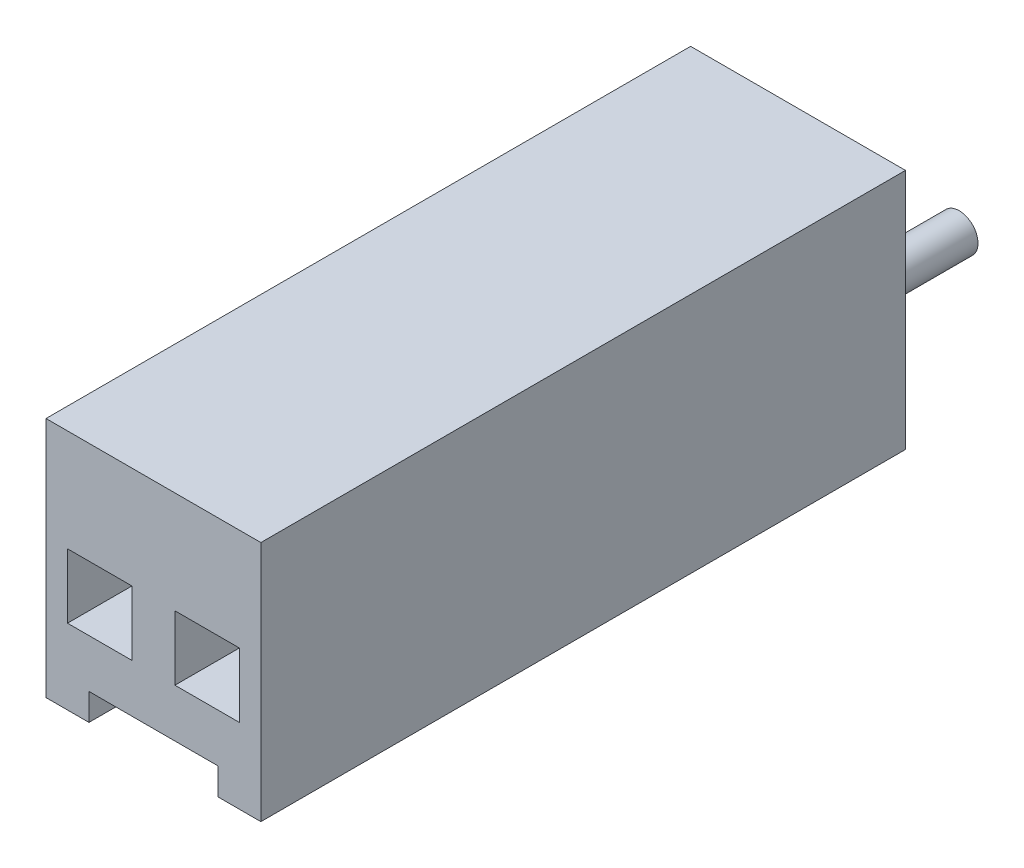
SolidWorks part; units mm, degrees
ref_plane "Front Plane" through (0, 0, 0) normal (0, 0, 1) x (1, 0, 0)
ref_plane "Top Plane" through (0, 0, 0) normal (0, 1, 0) x (1, 0, 0)
ref_plane "Right Plane" through (0, 0, 0) normal (1, 0, 0) x (0, 0, -1)
sketch "Sketch2" plane through (0, 0, 0) normal (0, 0, 1) x (1, 0, 0)
  line L1 (-1.27, 3.175) -> (3.81, 3.175)
  line L2 (-1.27, 3.175) -> (-1.27, -2.54)
  line L3 (-1.27, -2.54) -> (3.81, -2.54)
  line L4 (3.81, 3.175) -> (3.81, -2.54)
extrude "Boss-Extrude2" add sketch "Sketch2" along normal blind 2.54
sketch "Sketch3" plane through (0, 0, 2.54) normal (0, 0, 1) x (1, 0, 0)
  line L0 (-1.27, -2.54) -> (3.81, -2.54) construction
  line L1 (0, -2.54) -> (2.54, -2.54)
  line L2 (0, -2.54) -> (0, -1.905)
  line L3 (0, -1.905) -> (2.54, -1.905)
  line L4 (2.54, -2.54) -> (2.54, -1.905)
extrude "Boss-Extrude3" add sketch "Sketch3" along normal blind 7.62
sketch "Sketch4" plane through (0, 0, 2.54) normal (0, 0, 1) x (1, 0, 0)
  line L0 (3.81, -2.54) -> (3.81, 3.175) construction
  line L1 (-1.27, 3.175) -> (3.81, 3.175)
  line L2 (-1.27, 3.175) -> (-1.27, -1.905)
  line L3 (-1.27, -1.905) -> (3.81, -1.905)
  line L4 (3.81, 3.175) -> (3.81, -1.905)
extrude "Boss-Extrude4" add sketch "Sketch4" along normal blind 12.7
sketch "Sketch5" plane through (0, 0, 0) normal (0, 0, -1) x (-1, 0, 0)
  circle A0 centre (0, 0) radius 0.4445
  circle A1 centre (-2.54, 0) radius 0.4445
extrude "Boss-Extrude5" add sketch "Sketch5" along normal blind 2.54
sketch "Эскиз2" plane through (0, -1.905, 0) normal (0, -1, 0) x (1, 0, 0)
  line L1 (-1.27, 15.24) -> (-0.254, 15.24)
  line L2 (-1.27, 15.24) -> (-1.27, 2.54)
  line L3 (-1.27, 2.54) -> (-0.254, 2.54)
  line L4 (-0.254, 15.24) -> (-0.254, 2.54)
  line L5 (2.794, 15.24) -> (3.81, 15.24)
  line L6 (2.794, 15.24) -> (2.794, 2.54)
  line L7 (2.794, 2.54) -> (3.81, 2.54)
  line L8 (3.81, 15.24) -> (3.81, 2.54)
extrude "Бобышка-Вытянуть1" add sketch "Эскиз2" along normal blind 0.635
sketch "Эскиз3" plane through (0, 0, 15.24) normal (0, 0, 1) x (1, 0, 0)
  line L1 (-0.762, 0.762) -> (0.762, 0.762)
  line L2 (-0.762, 0.762) -> (-0.762, -0.762)
  line L3 (-0.762, -0.762) -> (0.762, -0.762)
  line L4 (0.762, 0.762) -> (0.762, -0.762)
  line L5 (1.778, 0.762) -> (3.302, 0.762)
  line L6 (1.778, 0.762) -> (1.778, -0.762)
  line L7 (1.778, -0.762) -> (3.302, -0.762)
  line L8 (3.302, 0.762) -> (3.302, -0.762)
extrude "Вырез-Вытянуть1" cut sketch "Эскиз3" against normal blind 12.7
